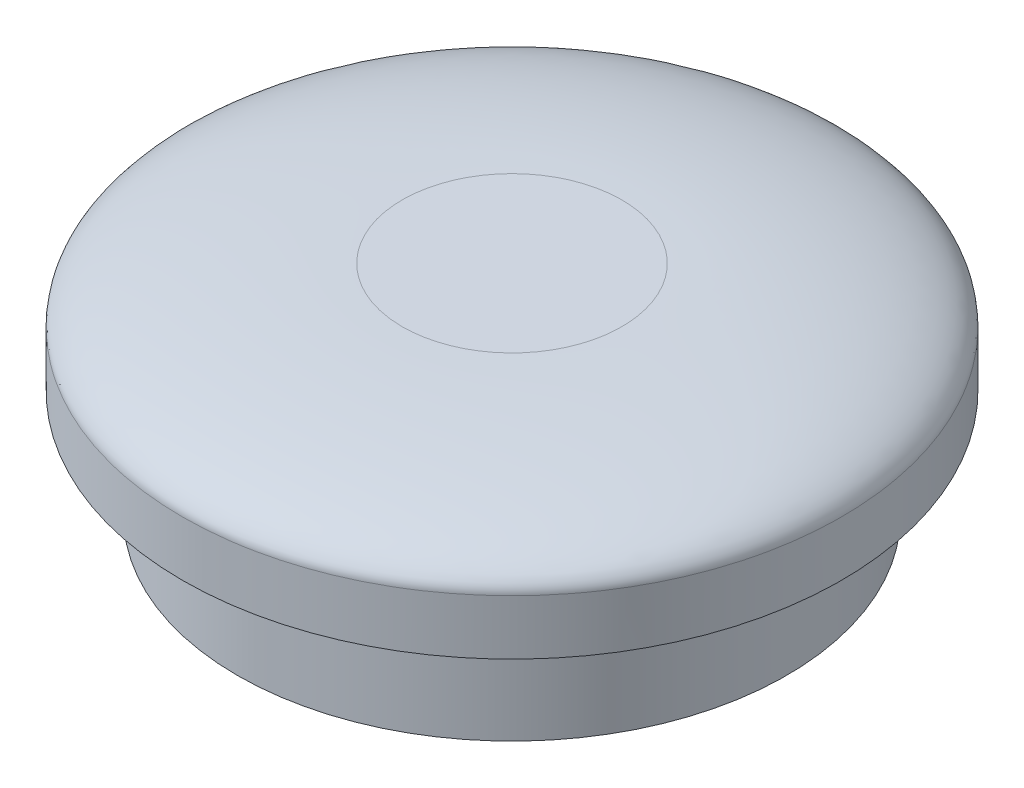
SolidWorks part; units mm, degrees
ref_plane "Front Plane" through (0, 0, 0) normal (0, 0, 1) x (1, 0, 0)
ref_plane "Top Plane" through (0, 0, 0) normal (0, 1, 0) x (1, 0, 0)
ref_plane "Right Plane" through (0, 0, 0) normal (1, 0, 0) x (0, 0, -1)
sketch "Sketch1" plane through (0, 0, 0) normal (0, 1, 0) x (1, 0, 0)
  circle A0 centre (0, 0) radius 25
  dimension "D1" = 50
extrude "Boss-Extrude1" add sketch "Sketch1" along normal blind 10
sketch "Sketch2" plane through (0, 10, 0) normal (0, 1, 0) x (1, 0, 0)
  circle A0 centre (0, 0) radius 30
  dimension "D1" = 60
extrude "Boss-Extrude2" add sketch "Sketch2" along normal blind 10
fillet "Fillet1" radius 5 1 edges at (0, 20, 30)
